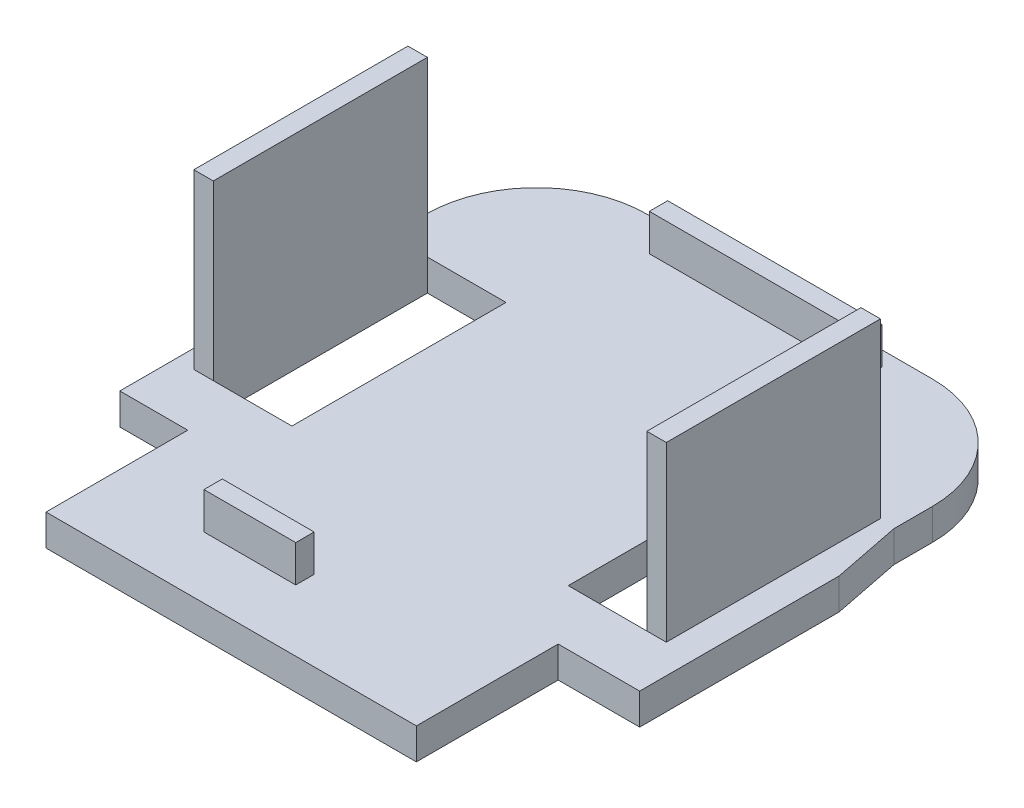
SolidWorks part; units mm, degrees
ref_plane "Front Plane" through (0, 0, 0) normal (0, 0, 1) x (1, 0, 0)
ref_plane "Top Plane" through (0, 0, 0) normal (0, 1, 0) x (1, 0, 0)
ref_plane "Right Plane" through (0, 0, 0) normal (1, 0, 0) x (0, 0, -1)
sketch "Sketch1" plane through (0, 0, 0) normal (0, 1, 0) x (1, 0, 0)
  line L0 (0, 0) -> (0, 9.8044)
  line L1 (0, 9.8044) -> (-4.699, 9.8044)
  line L2 (-4.699, 9.8044) -> (-4.699, 31.0007)
  line L3 (2.921, 38.6207) -> (22.6949, 38.6207)
  line L4 (12.8079, 38.6207) -> (12.8079, 0) construction
  line L5 (0, 0) -> (25.6159, 0)
  line L6 (30.3149, 31.0007) -> (30.3149, 28.3302)
  line L7 (25.6159, 9.8044) -> (31.2547, 9.8044)
  line L8 (25.6159, 0) -> (25.6159, 9.8044)
  line L9 (30.3149, 28.3302) -> (31.2547, 23.5966)
  line L10 (31.2547, 23.5966) -> (31.2547, 9.8044)
  arc A0 (-4.699, 31.0007) -> (2.921, 38.6207) centre (2.921, 31.0007) cw
  arc A1 (30.3149, 31.0007) -> (22.6949, 38.6207) centre (22.6949, 31.0007) ccw
  dimension "D7" = 7.62
  dimension "D1" = 35.9537
  dimension "D2" = 38.6207
  dimension "D3" = 5.6388
  dimension "D4" = 4.699
  dimension "D5" = 9.8044
  dimension "D6" = 4.826
  dimension "D8" = 13.7922
extrude "Boss-Extrude1" add sketch "Sketch1" along normal blind 2.159
sketch "Sketch2" plane through (0, 2.159, 0) normal (0, 1, 0) x (1, 0, 0)
  line L0 (22.6949, 38.6207) -> (2.921, 38.6207) construction
  line L1 (5.3911, 36.3347) -> (20.2247, 36.3347)
  line L2 (5.3911, 36.3347) -> (5.3911, 37.6047)
  line L3 (5.3911, 37.6047) -> (20.2247, 37.6047)
  line L4 (20.2247, 36.3347) -> (20.2247, 37.6047)
  line L5 (6.6548, 4.2672) -> (13.0048, 4.2672)
  line L6 (6.6548, 4.2672) -> (6.6548, 5.5372)
  line L7 (6.6548, 5.5372) -> (13.0048, 5.5372)
  line L8 (13.0048, 4.2672) -> (13.0048, 5.5372)
  line L9 (0, 9.8044) -> (0, 0) construction
  point P8 (12.8079, 37.6047)
  point P11 (12.8079, 38.6207)
  point P12 (6.6548, 4.9022)
  point P15 (0, 4.9022)
  dimension "D1" = 1.27
  dimension "D2" = 14.8336
  dimension "D3" = 1.016
  dimension "D4" = 6.6548
  dimension "D5" = 6.35
extrude "Boss-Extrude2" add sketch "Sketch2" along normal blind 2.54
sketch "Sketch3" plane through (0, 2.159, 0) normal (0, 1, 0) x (1, 0, 0)
  line L0 (-4.699, 31.0007) -> (-4.699, 9.8044) construction
  line L1 (-3.429, 28.4607) -> (-2.0828, 28.4607)
  line L2 (-3.429, 28.4607) -> (-3.429, 13.6525)
  line L3 (-3.429, 13.6525) -> (-2.0828, 13.6525)
  line L4 (-2.0828, 28.4607) -> (-2.0828, 13.6525)
  line L5 (27.9019, 13.6525) -> (29.2481, 13.6525)
  line L6 (27.9019, 13.6525) -> (27.9019, 28.4607)
  line L7 (27.9019, 28.4607) -> (29.2481, 28.4607)
  line L8 (29.2481, 13.6525) -> (29.2481, 28.4607)
  line L9 (31.2547, 9.8044) -> (31.2547, 23.5966) construction
  line L10 (22.6949, 38.6207) -> (2.921, 38.6207) construction
  dimension "D1" = 1.3462
  dimension "D2" = 1.27
  dimension "D3" = 2.0066
  dimension "D4" = 10.16
  dimension "D5" = 14.8082
extrude "Boss-Extrude3" add sketch "Sketch3" along normal blind 11.9634
sketch "Sketch4" plane through (0, 2.159, 0) normal (0, 1, 0) x (1, 0, 0)
  line L1 (-2.0828, 28.4607) -> (3.3528, 28.4607)
  line L2 (-2.0828, 28.4607) -> (-2.0828, 13.6525)
  line L3 (-2.0828, 13.6525) -> (3.3528, 13.6525)
  line L4 (3.3528, 28.4607) -> (3.3528, 13.6525)
  line L5 (27.9019, 28.4607) -> (22.4663, 28.4607)
  line L6 (27.9019, 28.4607) -> (27.9019, 13.6525)
  line L7 (27.9019, 13.6525) -> (22.4663, 13.6525)
  line L8 (22.4663, 28.4607) -> (22.4663, 13.6525)
  point P10 (0, 0)
  point P12 (0, 0)
  dimension "D1" = 5.4356
extrude "Cut-Extrude1" cut sketch "Sketch4" against normal through all
